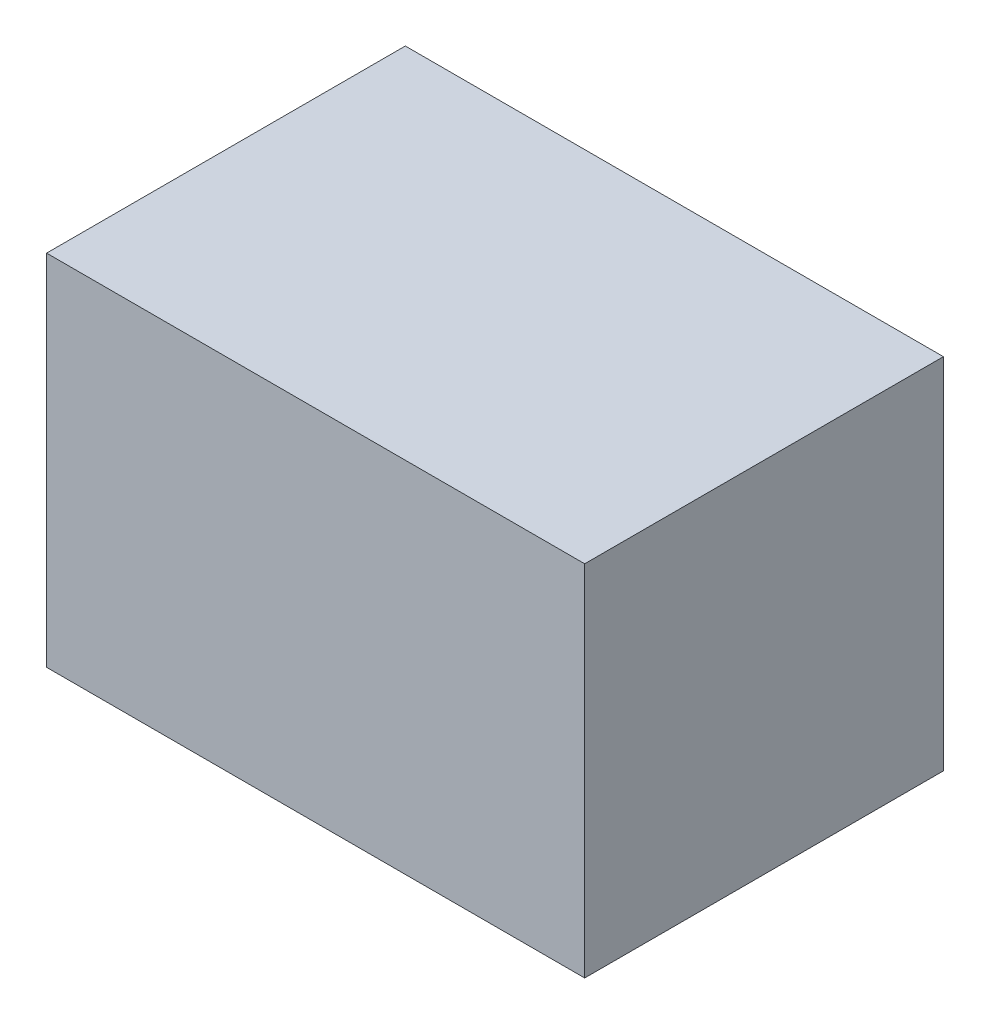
SolidWorks part; units mm, degrees
ref_plane "前视基准面" through (0, 0, 0) normal (0, 0, 1) x (1, 0, 0)
ref_plane "上视基准面" through (0, 0, 0) normal (0, 1, 0) x (1, 0, 0)
ref_plane "右视基准面" through (0, 0, 0) normal (1, 0, 0) x (0, 0, -1)
other "Configuration Table"
sketch "草图1" plane through (0, 0, 0) normal (0, 1, 0) x (1, 0, 0)
  line L1 (0, 0) -> (15, 0)
  line L2 (0, 0) -> (0, 10)
  line L3 (0, 10) -> (15, 10)
  line L4 (15, 0) -> (15, 10)
  dimension "D1" = 15
  dimension "D2" = 10
extrude "凸台-拉伸1" add sketch "草图1" along normal blind 10
